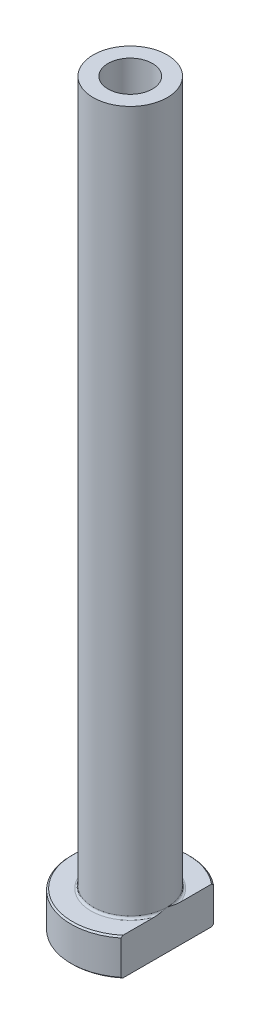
SolidWorks part; units mm, degrees
ref_plane "Front Plane" through (0, 0, 0) normal (0, 0, 1) x (1, 0, 0)
ref_plane "Top Plane" through (0, 0, 0) normal (0, 1, 0) x (1, 0, 0)
ref_plane "Right Plane" through (0, 0, 0) normal (1, 0, 0) x (0, 0, -1)
sketch "Sketch1" plane through (0, 0, 0) normal (0, 0, 1) x (1, 0, 0)
  line L0 (-3, 100) -> (-5, 100)
  line L1 (-5, 100) -> (-5, 5)
  line L2 (-5, 5) -> (-8, 5)
  line L3 (-8, 5) -> (-8, 0)
  line L4 (7.15, 0) -> (-7.15, 0) construction
  line L5 (-8, 0) -> (-3.25, 0)
  line L6 (-3, 55) -> (-3, 100)
  line L7 (0, 92.1877) -> (0, -15.5353) construction
  line L8 (0, -8.8) -> (0, 8.8) construction
  line L9 (-3, 55) -> (-3.25, 43)
  line L10 (-3.25, 43) -> (-3.25, 0)
  dimension "D1" = 0.25
  dimension "ID" = 6
  dimension "OD" = 10
  dimension "L" = 100
  dimension "H" = 16
  dimension "T" = 5
  dimension "N" = 45
  dimension "D2" = 12
  dimension "L-N" = 55
revolve "Revolve1" add sketch "Sketch1" angle 360 about L7
fillet "Fillet1" radius 0.3 1 edges at (0, 5, 5)
chamfer "Chamfer1" distance 0.2 angle 45 2 edges at (0, 5, 8) (0, 0, 8)
sketch "Sketch2" plane through (0, 0, 0) normal (0, -1, 0) x (1, 0, 0)
  line L0 (5, 6.245) -> (5, -6.245)
  circle A0 centre (0, 0) radius 8 construction
  arc A1 (5, 6.245) -> (5, -6.245) centre (0, 0) cw
  circle A2 centre (0, 0) radius 5 construction
extrude "Cut-Extrude1" cut sketch "Sketch2" against normal through all
chamfer "Chamfer2" distance 0.5 angle 45 1 edges at (0, 0, 3.25)
